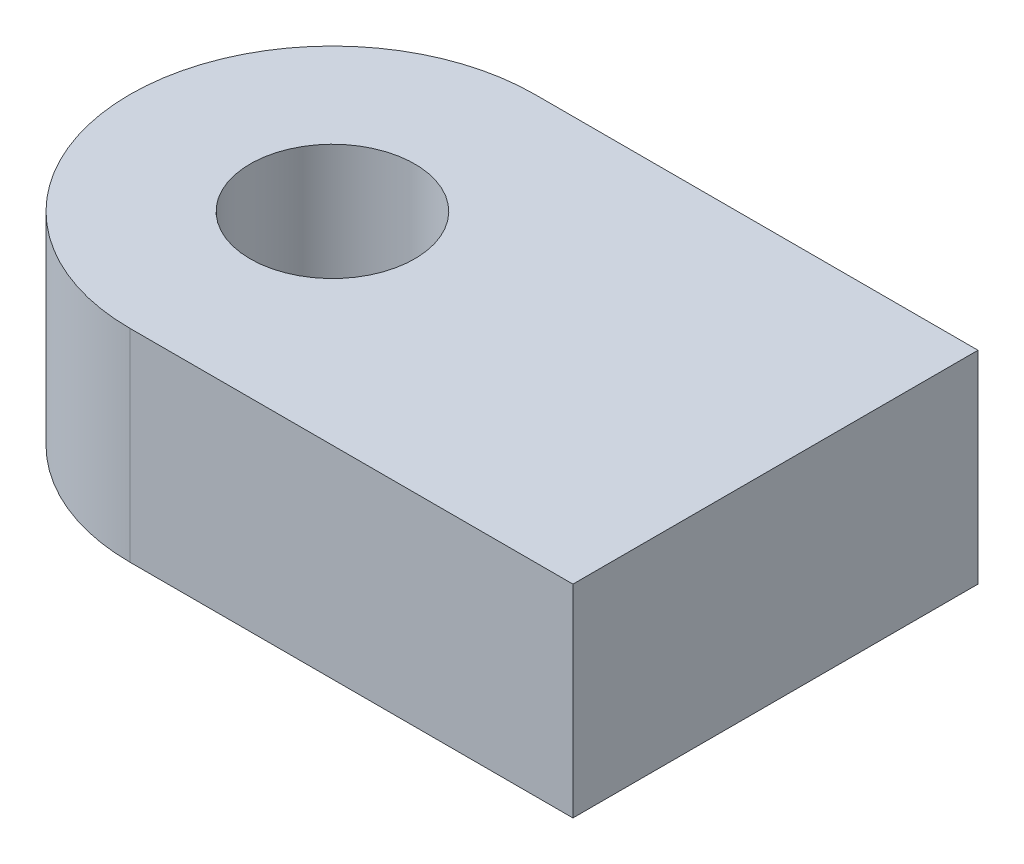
SolidWorks part; units mm, degrees
ref_plane "Front Plane" through (0, 0, 0) normal (0, 0, 1) x (1, 0, 0)
ref_plane "Top Plane" through (0, 0, 0) normal (0, 1, 0) x (1, 0, 0)
ref_plane "Right Plane" through (0, 0, 0) normal (1, 0, 0) x (0, 0, -1)
sketch "Sketch1" plane through (0, 0, 0) normal (0, 1, 0) x (1, 0, 0)
  line L0 (35, -16) -> (0, -16)
  line L1 (0, 16) -> (35, 16)
  line L2 (35, 16) -> (35, -16)
  arc A0 (0, -16) -> (0, 16) centre (0, 0) cw
  dimension "D1" = 16
  dimension "D2" = 35
extrude "Boss-Extrude1" add sketch "Sketch1" along normal blind 16
sketch "Sketch2" plane through (0, 16, 0) normal (0, 1, 0) x (1, 0, 0)
  circle A0 centre (0, 0) radius 6.5
  dimension "D1" = 13
extrude "Cut-Extrude1" cut sketch "Sketch2" against normal through all
